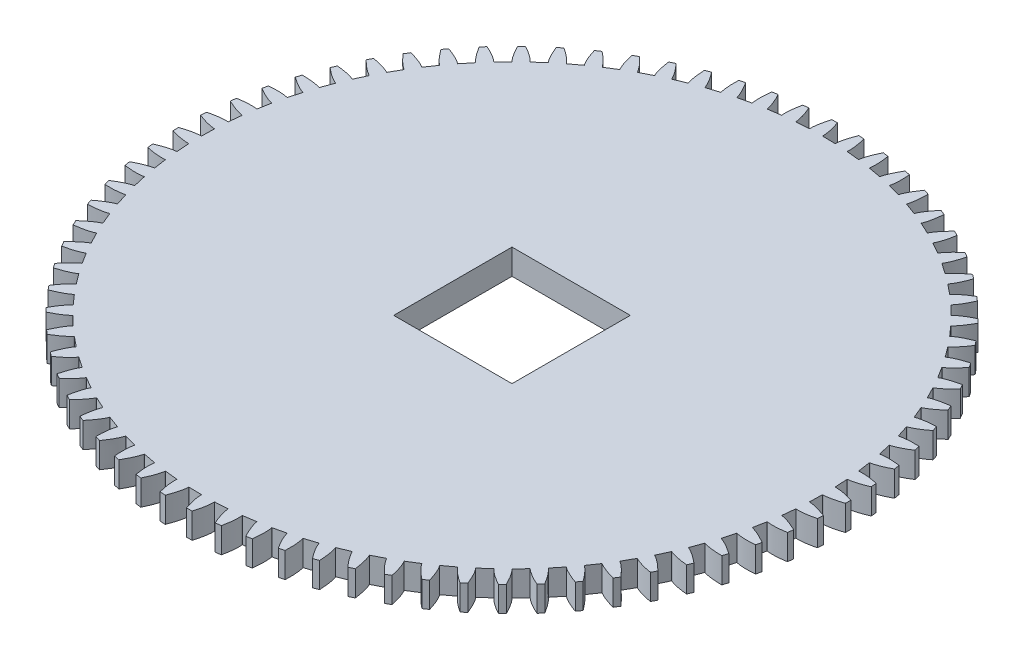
SolidWorks part; units mm, degrees
ref_plane "Front Plane" through (0, 0, 0) normal (0, 0, 1) x (1, 0, 0)
ref_plane "Top Plane" through (0, 0, 0) normal (0, 1, 0) x (1, 0, 0)
ref_plane "Right Plane" through (0, 0, 0) normal (1, 0, 0) x (0, 0, -1)
sketch "Sketch1" plane through (0, 0, 0) normal (0, 1, 0) x (1, 0, 0)
  line L0 (0, 0) -> (0, 18.3948) construction
  line L1 (0, 0) -> (-18.3948, 0) construction
  line L2 (0, 0) -> (-19.4958, -0.403) construction
  line L3 (0, 0) -> (-18.3791, -0.7602) construction
  line L4 (0, 0) -> (-18.332, -1.519) construction
  circle A0 centre (0, 0) radius 19 construction
  circle A1 centre (0, 0) radius 18.3948 construction
  circle A2 centre (0, 0) radius 18.375 construction
  circle A3 centre (0, 0) radius 19.5 construction
  spline S0 degree 4 poles (-18.3948, 0) (-18.4253, 0) (-18.5107, -0.0031) (-18.6716, -0.0214) (-18.9315, -0.0687) (-19.2579, -0.1543) (-19.6718, -0.2935) (-20.1472, -0.4935) (-20.6544, -0.7502) (-21.187, -1.0676) (-21.6995, -1.4175) (-22.1916, -1.7955) (-22.6634, -2.1985) (-23.2114, -2.7148) (-23.8349, -3.3752) (-24.5105, -4.197) (-25.2109, -5.1944) (-25.8493, -6.2594) (-26.4142, -7.3643) (-26.8458, -8.3616) (-27.1721, -9.232) (-27.4156, -9.9701) (-27.5932, -10.561) (-27.7948, -11.3165) (-27.9683, -12.0601) (-28.1159, -12.84) (-28.2597, -13.7311) (-28.356, -14.5513) (-28.4223, -15.2379) (-28.469, -16.1062) (-28.4845, -16.5496) (-28.4947, -17.1758) (-28.4901, -17.6402) (-28.4818, -18.0624) (-28.4716, -18.2985) (-28.4663, -18.4363) knots 0 0 0 0 0 0.005377 0.015084 0.028532 0.04661 0.064855 0.092111 0.119476 0.146842 0.174209 0.201575 0.228941 0.256307 0.307035 0.361767 0.4165 0.471232 0.525964 0.580697 0.608063 0.635429 0.662795 0.690161 0.744894 0.77226 0.799626 0.854358 0.881725 0.909091 0.931818 0.954545 0.977273 1 1 1 1 1 construction
  spline S1 degree 4 poles (-18.3948, 0) (-18.4253, 0) (-18.5107, -0.0031) (-18.6716, -0.0214) (-18.9315, -0.0687) (-19.2579, -0.1543) (-19.6718, -0.2935) (-20.1472, -0.4935) (-20.6544, -0.7502) (-21.187, -1.0676) (-21.6995, -1.4175) (-22.1916, -1.7955) (-22.6634, -2.1985) (-23.2114, -2.7148) (-23.8349, -3.3752) (-24.5105, -4.197) (-25.2109, -5.1944) (-25.8493, -6.2594) (-26.4142, -7.3643) (-26.8458, -8.3616) (-27.1721, -9.232) (-27.4156, -9.9701) (-27.5932, -10.561) (-27.7948, -11.3165) (-27.9683, -12.0601) (-28.1159, -12.84) (-28.2597, -13.7311) (-28.356, -14.5513) (-28.4223, -15.2379) (-28.461, -15.9569) (-28.4726, -16.2336) (-28.4773, -16.3744) knots 0 0 0 0 0 0.005377 0.015084 0.028532 0.04661 0.064855 0.092111 0.119476 0.146842 0.174209 0.201575 0.228941 0.256307 0.307035 0.361767 0.4165 0.471232 0.525964 0.580697 0.608063 0.635429 0.662795 0.690161 0.744894 0.77226 0.799626 0.854358 0.881725 0.909091 0.909091 0.909091 0.909091 0.909091
  dimension "D1" = 39
  dimension "D2" = 38
  dimension "D3" = 36.7896
  dimension "D4" = 36.75
  dimension "D5" = 18.3948
  dimension "D6" = 1.184
  dimension "D7" = 2.368
  dimension "D8" = 4.737
sketch "Sketch2" plane through (0, 0, 0) normal (0, 1, 0) x (1, 0, 0)
  line L0 (0, 0) -> (-19.4958, -0.403) construction
  line L1 (0, 0) -> (-19.4958, -0.403) construction
  line L2 (0, 0) -> (-18.3791, -0.7602) construction
  line L3 (0, 0) -> (-18.3948, 0) construction
  line L4 (0, 0) -> (-18.332, -1.519) construction
  line L5 (0, 0) -> (-18.3791, -0.7602) construction
  line L6 (0, 0) -> (-18.3948, 0) construction
  line L7 (0, 0) -> (-18.332, -1.519) construction
  line L8 (-18.3791, -0.7602) -> (-18.3593, -0.7593)
  line L9 (-18.3593, -0.7593) -> (-18.3122, -1.5174)
  line L10 (-18.3122, -1.5174) -> (-18.332, -1.519) construction
  line L11 (-18.3122, -1.5174) -> (-1.4949, -0.1239)
  line L12 (-18.3948, 0) -> (-1.5, 0)
  circle A0 centre (0, 0) radius 18.375 construction
  circle A1 centre (0, 0) radius 18.3948 construction
  circle A2 centre (0, 0) radius 19 construction
  circle A3 centre (0, 0) radius 19.5 construction
  circle A4 centre (0, 0) radius 18.375 construction
  circle A5 centre (0, 0) radius 18.3948 construction
  circle A6 centre (0, 0) radius 19 construction
  circle A7 centre (0, 0) radius 19.5 construction
  arc A8 (-19.4917, -0.5679) -> (-19.4985, -0.2381) centre (0, 0) cw
  circle A11 centre (0, 0) radius 1.5 construction
  arc A12 (-1.5, 0) -> (-1.4949, -0.1239) centre (0, 0) ccw
  spline S0 degree 4 poles (-44.7989, -999.5384) (-14.1249, -27.1372) (-15.2829, -0.6249) (-17.1526, 0.2548) (-18.9315, -0.0687) (-19.2579, -0.1543) (-19.6718, -0.2935) (-20.1472, -0.4935) (-20.6544, -0.7502) (-21.187, -1.0676) (-21.6995, -1.4175) (-22.1916, -1.7955) (-22.6634, -2.1985) (-23.2114, -2.7148) (-23.8349, -3.3752) (-24.5105, -4.197) (-25.2109, -5.1944) (-25.8493, -6.2594) (-26.4142, -7.3643) (-26.8458, -8.3616) (-27.1721, -9.232) (-27.4156, -9.9701) (-27.5932, -10.561) (-27.7948, -11.3165) (-27.9683, -12.0601) (-28.1159, -12.84) (-28.2597, -13.7311) (-28.356, -14.5513) (-28.5823, -16.8954) (-28.5635, -21.8425) (-26.9439, 15.3604) (-60.7103, -1015.7342) knots -0.272328 -0.272328 -0.272328 -0.272328 -0.272328 0.005377 0.015084 0.028532 0.04661 0.064855 0.092111 0.119476 0.146842 0.174209 0.201575 0.228941 0.256307 0.307035 0.361767 0.4165 0.471232 0.525964 0.580697 0.608063 0.635429 0.662795 0.690161 0.744894 0.77226 0.799626 0.854358 0.881725 1.239429 1.239429 1.239429 1.239429 1.239429 only from (-18.3948, 0) to (-28.4773, -16.3744) construction
  spline S1 degree 4 poles (-18.3948, 0) (-18.4253, 0) (-18.5107, -0.0031) (-18.6716, -0.0214) (-18.9315, -0.0687) (-19.1764, -0.1329) (-19.3653, -0.1922) (-19.4804, -0.2317) (-19.4985, -0.2381) knots 0 0 0 0 0 0.005377 0.015084 0.028532 0.04661 0.050009 0.050009 0.050009 0.050009 0.050009
  spline S2 degree 4 poles (-18.3791, -0.7602) (-18.4095, -0.7614) (-18.495, -0.7618) (-18.6565, -0.7502) (-18.9182, -0.7137) (-19.1655, -0.6597) (-19.3567, -0.6082) (-19.4733, -0.5735) (-19.4917, -0.5679) knots 0 0 0 0 0 0.005377 0.015084 0.028532 0.04661 0.050009 0.050009 0.050009 0.050009 0.050009
  point P21 (-18.3593, -0.7593)
  point P24 (-18.3122, -1.5174)
  dimension "D2" = 3
extrude "Boss-Extrude1" add sketch "Sketch2" along normal blind 1.5
pattern_circular "CirPattern1" count 76 over 360 of "Boss-Extrude1"
sketch "Sketch3" plane through (0, 1.5, 0) normal (0, 1, 0) x (1, 0, 0)
  line L1 (-3.5, -3.5) -> (3.5, -3.5)
  line L2 (-3.5, -3.5) -> (-3.5, 3.5)
  line L3 (-3.5, 3.5) -> (3.5, 3.5)
  line L4 (3.5, -3.5) -> (3.5, 3.5)
  line L5 (-3.5, -3.5) -> (3.5, 3.5) construction
  line L6 (-3.5, 3.5) -> (3.5, -3.5) construction
  point P0 (0, 0)
  dimension "D1" = 7
extrude "Cut-Extrude1" cut sketch "Sketch3" against normal up to surface (1.5 mm away)
equation "\"Module\"= .5"
equation "\"Number of Teeth\"= 76"
equation "\"Pressure Angle\"= 14.5deg"
equation "\"Pitch Diameter\"= \"Number of Teeth\" * \"Module\""
equation "\"Circular Pitch\"= pi * \"Module\""
equation "\"Addendum\"= \"Module\""
equation "\"Dedendum\"= 1.25 * \"Module\""
equation "\"Base Diameter\"= \"Pitch Diameter\" * cos ( \"Pressure Angle\" )"
equation "\"Base Radius\"= \"Base Diameter\" / 2"
equation "\"Width\"= 1.5"
equation "\"Outside Diameter\"= \"Pitch Diameter\" + 2 * \"Addendum\""
equation "\"D1@Sketch1\"=\"Outside Diameter\""
equation "\"D3@Sketch1\"=\"Base Diameter\""
equation "\"Root Diameter\"= \"Pitch Diameter\" - 2 * \"Dedendum\""
equation "\"D4@Sketch1\"=\"Root Diameter\""
equation "\"Tooth Angle\"= 360 / \"Number of Teeth\""
equation "\"D6@Sketch1\"=\"Tooth Angle\"/4"
equation "\"D7@Sketch1\"=\"Tooth Angle\"/2"
equation "\"D8@Sketch1\"=\"Tooth Angle\""
equation "\"D2@Sketch1\" = \"Pitch Diameter\""
equation "\"Shaft Diameter\"= 3"
equation "\"D1@CirPattern1\" = \"Number of Teeth\""
equation "\"D2@Sketch2\"= \"Shaft Diameter\""
equation "\"D1@Boss-Extrude1\" = \"Width\""
